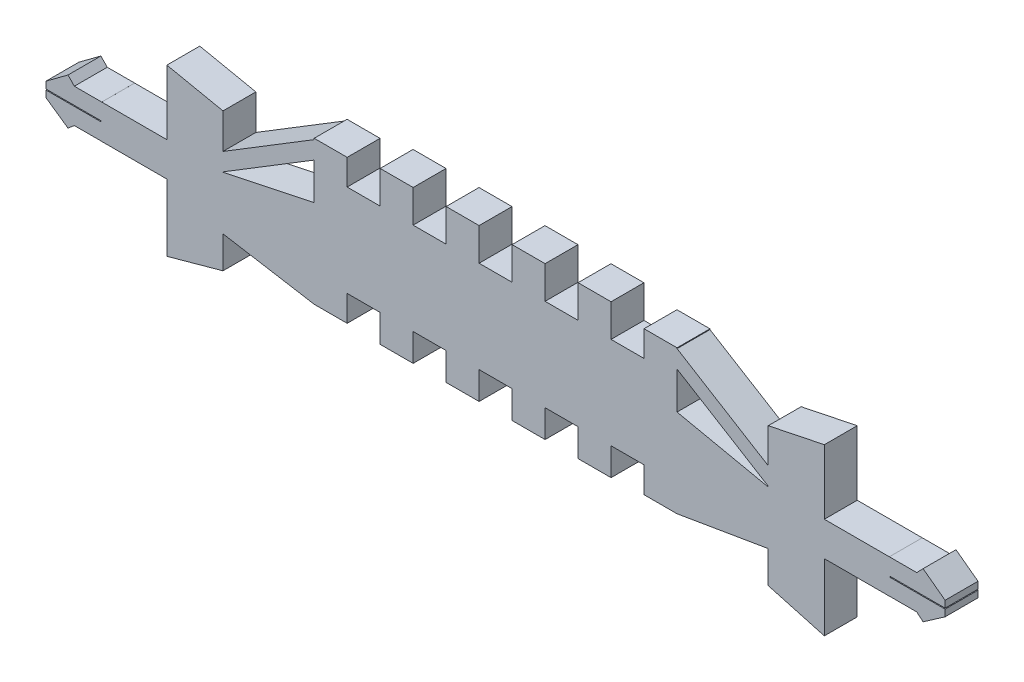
SolidWorks part; units mm, degrees
ref_plane "Alzado" through (0, 0, 0) normal (0, 0, 1) x (1, 0, 0)
ref_plane "Planta" through (0, 0, 0) normal (0, 1, 0) x (1, 0, 0)
ref_plane "Vista lateral" through (0, 0, 0) normal (1, 0, 0) x (0, 0, -1)
sketch "Croquis2" plane through (0, 0, 0) normal (0, 0, 1) x (1, 0, 0)
sketch_block_instance "F1 CAR CUT corte-1"
sketch_block "Bloque1"
extrude "Saliente-Extruir1" add sketch "Croquis2" along normal blind 3
delete or keep bodies "Sólido-Eliminar/Conservar 27" type delete bodies bodies 109 105 110 106 111 107
delete or keep bodies "Sólido-Eliminar/Conservar 33" type delete bodies bodies 102 101 103 108
delete or keep bodies "Sólido-Eliminar/Conservar 37" type delete bodies bodies 112 104 113
